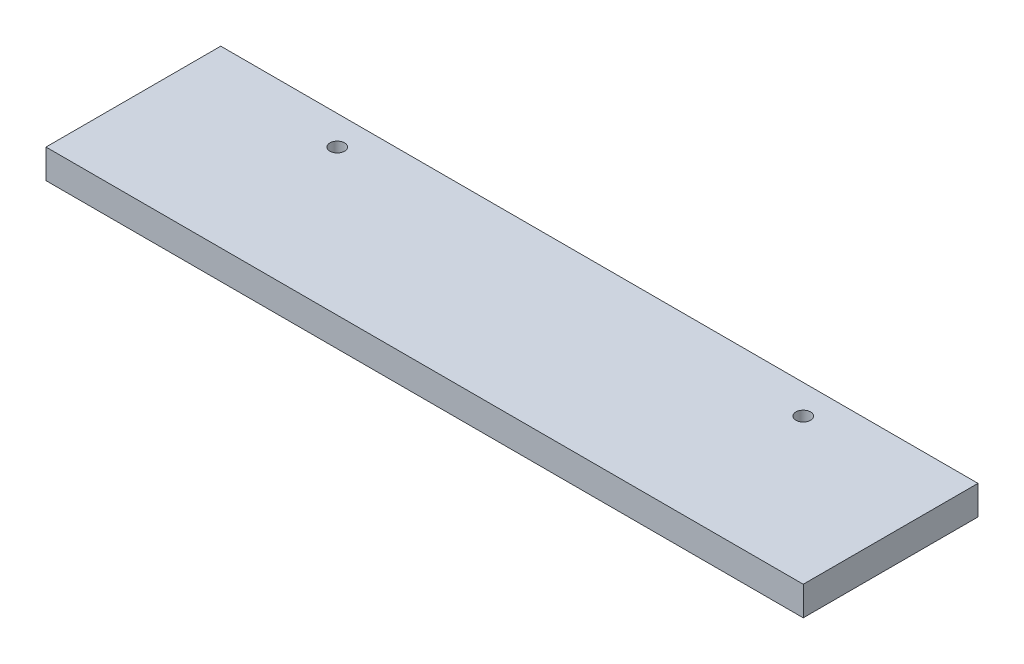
SolidWorks part; units mm, degrees
ref_plane "Front Plane" through (0, 0, 0) normal (0, 0, 1) x (1, 0, 0)
ref_plane "Top Plane" through (0, 0, 0) normal (0, 1, 0) x (1, 0, 0)
ref_plane "Right Plane" through (0, 0, 0) normal (1, 0, 0) x (0, 0, -1)
sketch "Sketch1" plane through (0, 0, 0) normal (0, 1, 0) x (1, 0, 0)
  line L1 (0, 0) -> (82.55, 0)
  line L2 (0, 0) -> (0, 19.05)
  line L3 (0, 19.05) -> (82.55, 19.05)
  line L4 (82.55, 0) -> (82.55, 19.05)
  dimension "D1" = 82.55
  dimension "D2" = 19.05
extrude "Boss-Extrude1" add sketch "Sketch1" along normal blind 3.175
sketch "Sketch2" plane through (0, 3.175, 0) normal (0, 1, 0) x (1, 0, 0)
  line L0 (0, 19.05) -> (0, 0) construction
  line L1 (82.55, 0) -> (82.55, 19.05) construction
  line L2 (82.55, 19.05) -> (0, 19.05) construction
  circle A0 centre (15.875, 15.875) radius 0.7937
  circle A1 centre (66.675, 15.875) radius 0.7937
  dimension "D5" = 1.5875
  dimension "D6" = 1.5875
  dimension "D1" = 15.875
  dimension "D2" = 15.875
  dimension "D3" = 3.175
  dimension "D4" = 3.175
extrude "Cut-Extrude1" cut sketch "Sketch2" against normal through all
